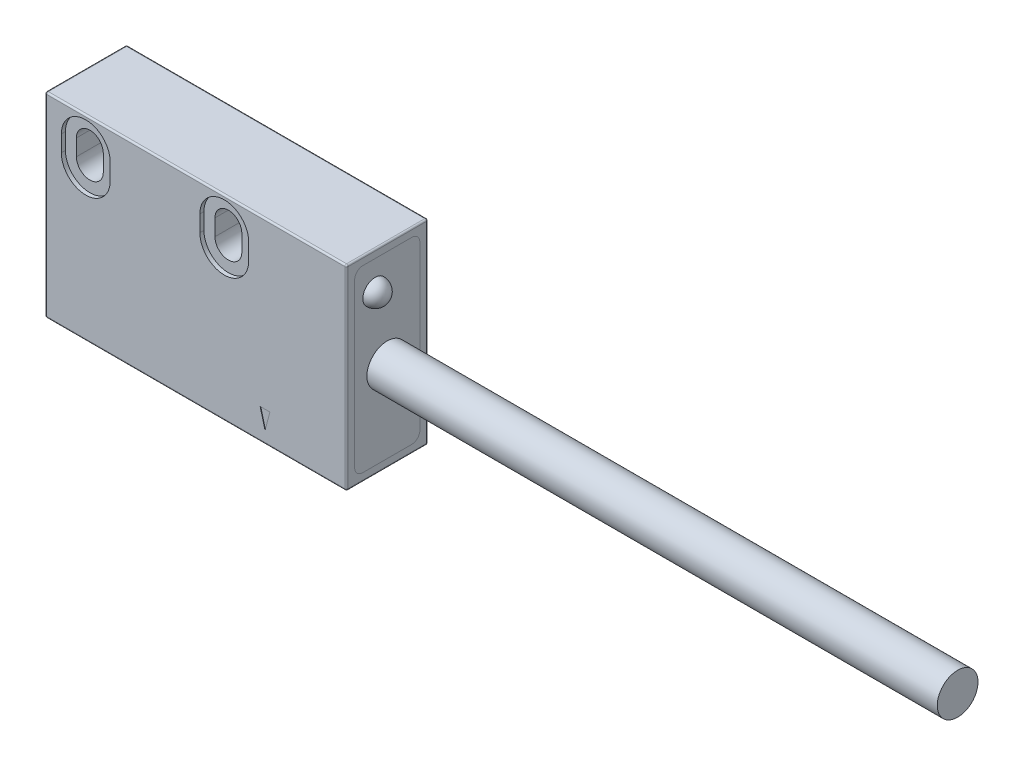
SolidWorks part; units mm, degrees
ref_plane "前视" through (0, 0, 0) normal (0, 0, 1) x (1, 0, 0)
ref_plane "上视" through (0, 0, 0) normal (0, 1, 0) x (1, 0, 0)
ref_plane "右视" through (0, 0, 0) normal (1, 0, 0) x (0, 0, -1)
sketch "草图1" plane through (0, 0, 0) normal (0, 0, 1) x (1, 0, 0)
  line L1 (-14.1176, 5.916) -> (22.8824, 5.916)
  line L2 (-14.1176, 5.916) -> (-14.1176, -18.084)
  line L3 (-14.1176, -18.084) -> (22.8824, -18.084)
  line L4 (22.8824, 5.916) -> (22.8824, -18.084)
  dimension "D1" = 37
  dimension "D2" = 24
extrude "凸台-拉伸1" add sketch "草图1" along normal blind 10
sketch "草图2" plane through (0, 0, 10) normal (0, 0, 1) x (1, 0, 0)
  line L0 (-9.1176, 2.416) -> (-9.1176, 0.416) construction
  line L1 (-7.4676, 2.416) -> (-7.4676, 0.416)
  line L2 (-10.7676, 2.416) -> (-10.7676, 0.416)
  line L3 (7.8824, 2.416) -> (7.8824, 0.416) construction
  line L4 (9.5324, 2.416) -> (9.5324, 0.416)
  line L5 (6.2324, 2.416) -> (6.2324, 0.416)
  line L6 (-14.1176, 5.916) -> (-14.1176, -18.084) construction
  line L7 (22.8824, 5.916) -> (-14.1176, 5.916) construction
  line L8 (-9.1176, 1.416) -> (7.8824, 1.416) construction
  arc A0 (-7.4676, 2.416) -> (-10.7676, 2.416) centre (-9.1176, 2.416) ccw
  arc A1 (-10.7676, 0.416) -> (-7.4676, 0.416) centre (-9.1176, 0.416) ccw
  arc A2 (9.5324, 2.416) -> (6.2324, 2.416) centre (7.8824, 2.416) ccw
  arc A3 (6.2324, 0.416) -> (9.5324, 0.416) centre (7.8824, 0.416) ccw
  point P2 (-9.1176, 1.416)
  point P9 (7.8824, 1.416)
  dimension "D2" = 3.3
  dimension "D1" = 2
  dimension "D3" = 5
  dimension "D4" = 17
  dimension "D5" = 4.5
extrude "切除-拉伸1" cut sketch "草图2" against normal through all
sketch "草图3" plane through (0, 0, 10) normal (0, 0, 1) x (1, 0, 0)
  line L0 (-9.1176, 2.416) -> (-9.1176, 0.416) construction
  line L1 (-6.1176, 2.416) -> (-6.1176, 0.416)
  line L2 (-12.1176, 2.416) -> (-12.1176, 0.416)
  line L3 (7.8824, 2.416) -> (7.8824, 0.416) construction
  line L4 (10.8824, 2.416) -> (10.8824, 0.416)
  line L5 (4.8824, 2.416) -> (4.8824, 0.416)
  arc A0 (-6.1176, 2.416) -> (-12.1176, 2.416) centre (-9.1176, 2.416) ccw
  arc A1 (-12.1176, 0.416) -> (-6.1176, 0.416) centre (-9.1176, 0.416) ccw
  arc A2 (10.8824, 2.416) -> (4.8824, 2.416) centre (7.8824, 2.416) ccw
  arc A3 (4.8824, 0.416) -> (10.8824, 0.416) centre (7.8824, 0.416) ccw
  point P4 (-9.1176, 1.416)
  point P13 (7.8824, 1.416)
  dimension "D1" = 6
  dimension "D2" = 6
extrude "切除-拉伸3" cut sketch "草图3" against normal blind 0.5
ref_plane "基准面1" through (0, 0, 5) normal (0, 0, -1) x (-1, 0, 0)
mirror "镜向1" about plane through (0, 0, 5) normal (0, 0, -1) of "切除-拉伸3"
sketch "草图4" plane through (22.8824, 0, 0) normal (1, 0, 0) x (0, 0, -1)
  line L0 (-10, -18.084) -> (0, -18.084) construction
  line L1 (-9, 4.916) -> (-1, 4.916)
  line L2 (-9, 4.916) -> (-9, -17.084)
  line L3 (-9, -17.084) -> (-1, -17.084)
  line L4 (-1, 4.916) -> (-1, -17.084)
  line L5 (-10, 5.916) -> (0, 5.916) construction
  line L6 (-10, -18.084) -> (-10, 5.916) construction
  line L7 (0, -18.084) -> (0, 5.916) construction
  dimension "D1" = 1
  dimension "D2" = 1
  dimension "D3" = 1
  dimension "D4" = 1
extrude "切除-拉伸4" cut sketch "草图4" against normal blind 10
fillet "圆角3" radius 0.2 11 edges at (22.8824, 5.916, 5) (4.3824, -18.084, 0) (22.8824, -6.084, 0) (4.3824, 5.916, 0) (4.3824, 5.916, 10) (22.8824, -6.084, 10) (4.3824, -18.084, 10) (-14.1176, 5.916, 5) (-14.1176, -6.084, 10) (-14.1176, -18.084, 5) (-14.1176, -6.084, 0)
sketch "草图8" plane through (0, 0, 10) normal (0, 0, 1) x (1, 0, 0)
  line L0 (12.2824, -14.3448) -> (13.4824, -14.3448)
  line L1 (13.4824, -14.3448) -> (12.8824, -16.584)
  line L2 (12.8824, -16.584) -> (12.2824, -14.3448)
  line L3 (12.8824, -14.3448) -> (12.8824, -16.584) construction
  line L4 (22.8824, -18.084) -> (-13.9176, -18.084) construction
  line L5 (22.8824, 5.716) -> (22.8824, -18.084) construction
  dimension "D1" = 1.2
  dimension "D2" = 30
  dimension "D3" = 1.5
  dimension "D4" = 10
extrude "切除-拉伸8" cut sketch "草图8" against normal blind 0.058 contours L1 L2 L0
ref_plane "基准面2" through (0, 0, 5) normal (0, 0, 1) x (1, 0, 0)
mirror "镜向2" about plane through (0, 0, 5) normal (0, 0, 1) of "切除-拉伸8"
fillet "圆角4" radius 0.2 3 edges at (22.8238, -18.0255, 9.9414) (22.8238, -18.0255, 0.0586) (22.8824, -18.084, 5)
fillet "圆角5" radius 1 4 edges at (17.8824, -17.084, 1) (17.8824, -17.084, 9) (17.8824, 4.916, 9) (17.8824, 4.916, 1)
sketch "草图9" plane through (12.8824, 0, 0) normal (1, 0, 0) x (0, 0, -1)
  line L0 (-2, 4.916) -> (-8, 4.916) construction
  line L1 (-8, 4.916) -> (-2, 4.916)
  line L2 (-9, 3.916) -> (-9, -16.084)
  line L3 (-8, -17.084) -> (-2, -17.084)
  line L4 (-1, 3.916) -> (-1, -16.084)
  line L5 (-1, -16.084) -> (-1, 3.916) construction
  line L6 (-9, 3.916) -> (-9, -16.084) construction
  line L7 (-8, -17.084) -> (-2, -17.084) construction
  arc A0 (-2, -17.084) -> (-1, -16.084) centre (-2, -16.084) ccw
  arc A1 (-9, -16.084) -> (-8, -17.084) centre (-8, -16.084) ccw
  arc A2 (-2, 4.916) -> (-1, 3.916) centre (-2, 3.916) cw
  arc A3 (-8, 4.916) -> (-9, 3.916) centre (-8, 3.916) ccw
  dimension "D1" = 1
extrude "凸台-拉伸2" add sketch "草图9" along normal blind 10 separate body
sketch "草图10" plane through (22.8824, 0, 0) normal (1, 0, 0) x (0, 0, -1)
  line L0 (-9.8, 5.916) -> (-0.2, 5.916) construction
  line L1 (-10, -17.884) -> (-10, 5.716) construction
  line L2 (-6.5, 2.916) -> (-6.5, -0.084) construction
  line L3 (-6.5, 2.916) -> (-6.5, -0.084)
  arc A0 (-6.5, -0.084) -> (-6.5, 2.916) centre (-6.5, 1.416) ccw
  dimension "D1" = 3
  dimension "D2" = 4.5
  dimension "D3" = 3.5
revolve "旋转4" add sketch "草图10" angle 360 about L2
sketch "草图11" plane through (22.8824, 0, 0) normal (1, 0, 0) x (0, 0, -1)
  line L0 (-10, -17.884) -> (-10, 5.716) construction
  line L1 (-9.8, 5.916) -> (-0.2, 5.916) construction
  circle A0 centre (-5, -7.084) radius 2.5
  dimension "D1" = 5
  dimension "D2" = 5
  dimension "D3" = 13
extrude "凸台-拉伸3" add sketch "草图11" along normal blind 70 separate body
